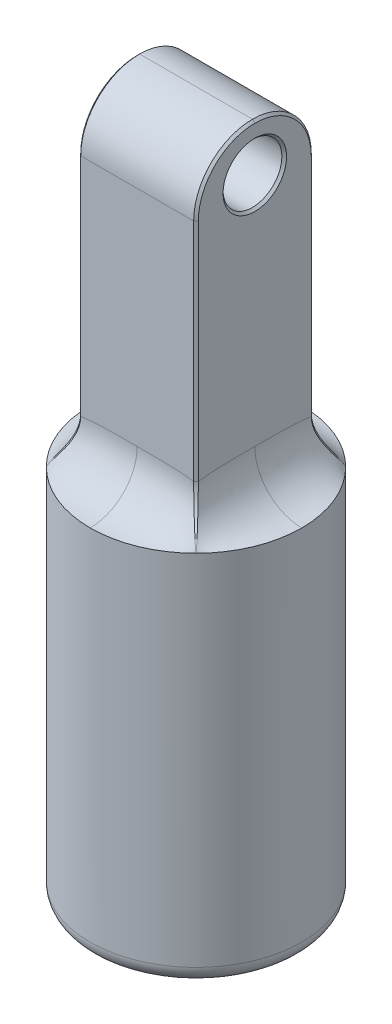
SolidWorks part; units mm, degrees
ref_plane "Top Plane" through (0, 0, 0) normal (0, 0, 1) x (1, 0, 0)
ref_plane "Front Plane" through (0, 0, 0) normal (0, 1, 0) x (1, 0, 0)
ref_plane "Right Plane" through (0, 0, 0) normal (1, 0, 0) x (0, 0, -1)
sketch "Sketch1" plane through (0, 0, 0) normal (0, 1, 0) x (1, 0, 0)
  line L1 (-5, -5) -> (5, -5) construction
  line L2 (-5, -5) -> (-5, 5) construction
  line L3 (-5, 5) -> (5, 5) construction
  line L4 (5, -5) -> (5, 5) construction
  line L5 (-5, -5) -> (5, 5) construction
  line L6 (-5, 5) -> (5, -5) construction
  circle A0 centre (0, 0) radius 7.0711
  dimension "D1" = 10
extrude "Boss-Extrude1" add sketch "Sketch1" along normal blind 25 contours A0
sketch "Sketch4" plane through (0, 0, 0) normal (0, -1, 0) x (1, 0, 0)
  circle A0 centre (0, 0) radius 9
  dimension "D1" = 18
extrude "Boss-Extrude3" add sketch "Sketch4" along normal blind 5
sketch "Sketch5" plane through (0, -5, 0) normal (0, -1, 0) x (-1, 0, 0)
  circle A0 centre (0, 0) radius 9
  dimension "D1" = 18
extrude "Boss-Extrude4" add sketch "Sketch5" along normal blind 30
sketch "Sketch3" plane through (0, 25, 0) normal (0, 1, 0) x (1, 0, 0)
  line L1 (-5, -5) -> (5, -5)
  line L2 (-5, -5) -> (-5, 5)
  line L3 (-5, 5) -> (5, 5)
  line L4 (5, -5) -> (5, 5)
  line L5 (-5, -5) -> (5, 5) construction
  line L6 (-5, 5) -> (5, -5) construction
  circle A0 centre (0, 0) radius 18.8855
  point P0 (0, 0)
  dimension "D1" = 10
extrude "Cut-Extrude1" cut sketch "Sketch3" against normal blind 28
fillet "Fillet1" radius 4 4 edges at (-5, -3, 0) (0, -3, -5) (5, -3, 0) (0, -3, 5)
sketch "Sketch7" plane through (5, 0, 0) normal (1, 0, 0) x (0, 0, -1)
  line L0 (0, 25) -> (0, 1) construction
  line L1 (-5, 25) -> (5, 25) construction
  circle A0 centre (0, 21) radius 2.5
  point P2 (0, 19.5931)
  point P3 (0, -0.5)
  point P8 (0, 1.6894)
  point P9 (0, 21)
  point P11 (0, 25)
  dimension "D2" = 5
  dimension "D1" = 4
extrude "Cut-Extrude2" cut sketch "Sketch7" against normal up to next
fillet "Fillet2" radius 5 2 edges at (0, 25, -5) (0, 25, 5)
fillet "Fillet3" radius 1.5 1 edges at (0, -35, -9)
chamfer "Chamfer3" distance 0.2 angle 45 2 edges at (-5, 21, 2.5) (5, 21, -2.5)
chamfer "Chamfer4" distance 0.2 angle 45 12 edges at (5, 10.3922, -5) (-5, 10.3922, -5) (5.8995, -2.0772, -5.8995) (5, 23.5355, -3.5355) (5.8995, -2.0772, 5.8995) (5, 23.5355, 3.5355) (5, 10.3922, 5) (-5.8995, -2.0772, -5.8995) (-5, 23.5355, -3.5355) (-5.8995, -2.0772, 5.8995) (-5, 23.5355, 3.5355) (-5, 10.3922, 5)
